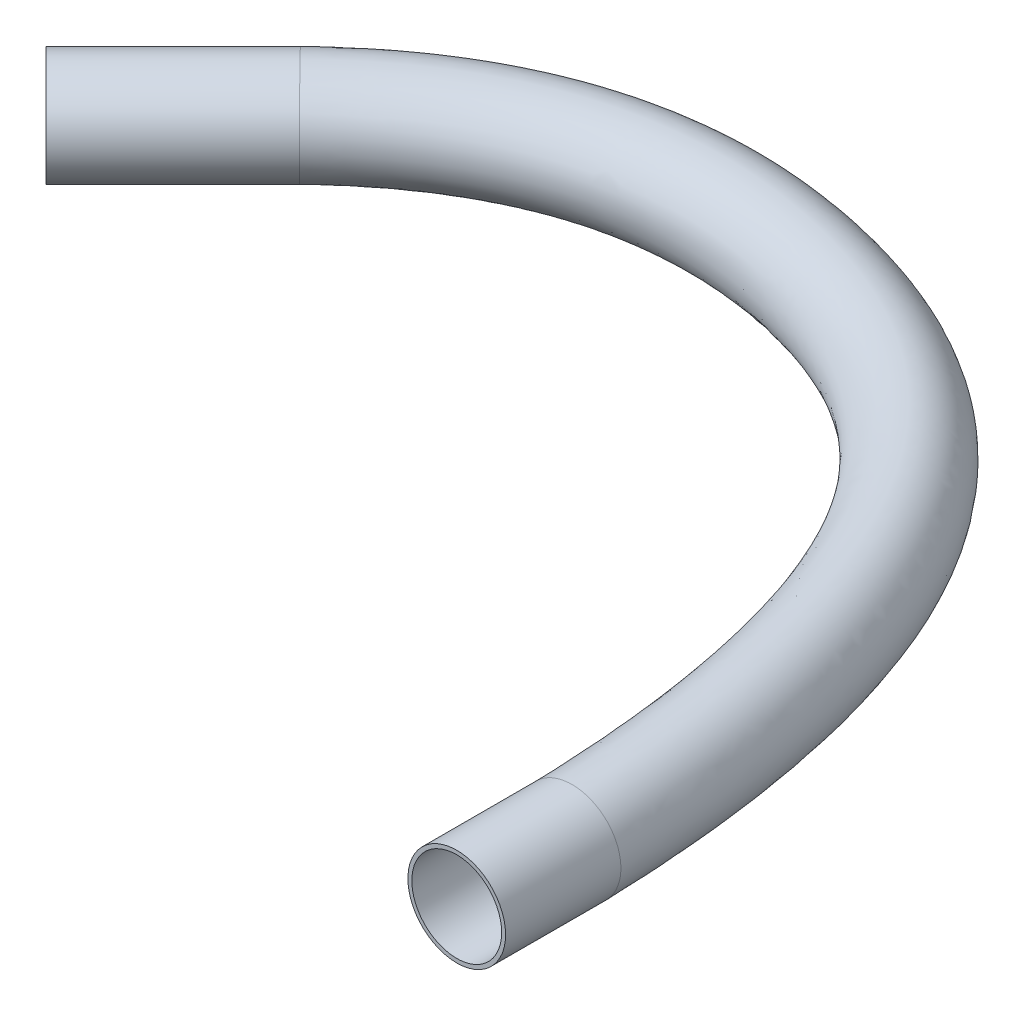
SolidWorks part; units mm, degrees
ref_plane "前视基准面" through (0, 0, 0) normal (0, 0, 1) x (1, 0, 0)
ref_plane "上视基准面" through (0, 0, 0) normal (0, 1, 0) x (1, 0, 0)
ref_plane "右视基准面" through (0, 0, 0) normal (1, 0, 0) x (0, 0, -1)
sketch "草图1" plane through (0, 0, 0) normal (0, 0, 1) x (1, 0, 0)
  circle A0 centre (0, 0) radius 21.75
  circle A1 centre (0, 0) radius 20
  dimension "D1" = 43.5
  dimension "D2" = 40
sketch "草图2" plane through (0, 0, 0) normal (0, 1, 0) x (1, 0, 0)
  line L0 (0, 0) -> (0, 51)
  line L1 (-340, 270.23) -> (-396.5685, 213.6615)
  spline S0 degree 3 poles (0, 51) (-5.7697, 226.6777) (-106.2727, 341.6) (-278.1563, 329.7158) (-340, 270.23) knots 0 0 0 0 0.625779 1 1 1 1
  dimension "D1" = 51
  dimension "D2" = 80
  dimension "D3" = 45
  dimension "D4" = 340
  dimension "D5" = 270.23
sweep "扫描1" add profiles "草图1" path "草图2"
